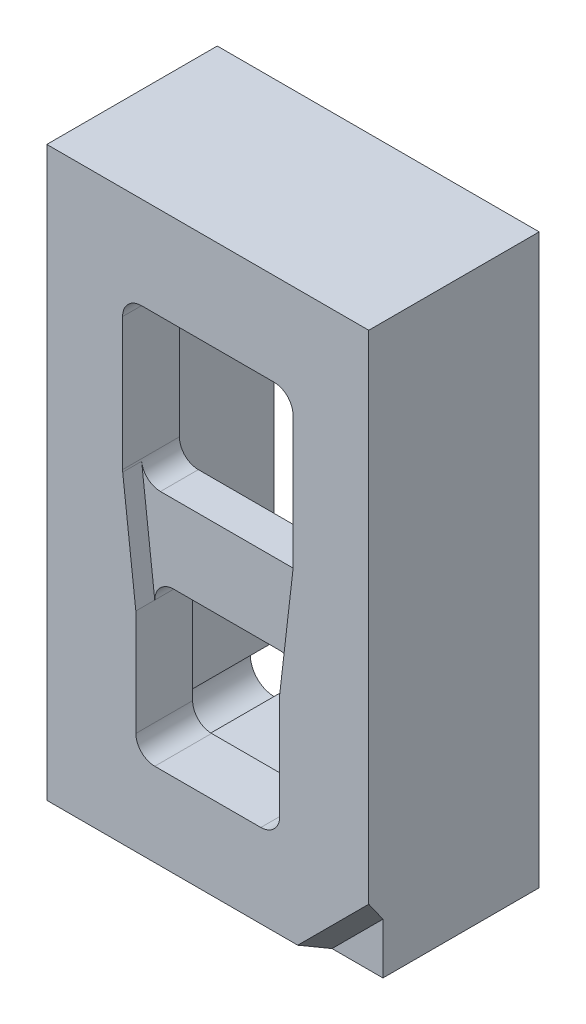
SolidWorks part; units mm, degrees
ref_plane "Front Plane" through (0, 0, 0) normal (0, 0, 1) x (1, 0, 0)
ref_plane "Top Plane" through (0, 0, 0) normal (0, 1, 0) x (1, 0, 0)
ref_plane "Right Plane" through (0, 0, 0) normal (1, 0, 0) x (0, 0, -1)
sketch "Sketch1" plane through (0, 0, 0) normal (0, 0, 1) x (1, 0, 0)
  line L0 (0, 0) -> (0, 1.125) construction
  line L1 (1.1, -2.4) -> (-1.1, -2.4)
  line L2 (1.1, -2.4) -> (1.1, 2.4)
  line L3 (1.1, 2.4) -> (-1.1, 2.4)
  line L4 (-1.1, -2.4) -> (-1.1, 2.4)
  line L5 (1.1, -2.4) -> (-1.1, 2.4) construction
  line L6 (1.1, 2.4) -> (-1.1, -2.4) construction
  line L7 (0, 0) -> (0, -1.258) construction
  line L8 (0, -1.258) -> (0, -1.358) construction
  line L9 (-0.9, 0.225) -> (0.9, 0.225)
  line L10 (-0.9, 0.225) -> (-0.9, 2.025)
  line L11 (-0.9, 2.025) -> (0.9, 2.025)
  line L12 (0.9, 0.225) -> (0.9, 2.025)
  line L13 (-0.9, 0.225) -> (0.9, 2.025) construction
  line L14 (-0.9, 2.025) -> (0.9, 0.225) construction
  line L15 (-0.76, -0.598) -> (0.76, -0.598)
  line L16 (-0.76, -0.598) -> (-0.76, -2.118)
  line L17 (-0.76, -2.118) -> (0.76, -2.118)
  line L18 (0.76, -0.598) -> (0.76, -2.118)
  line L19 (-0.76, -0.598) -> (0.76, -2.118) construction
  line L20 (-0.76, -2.118) -> (0.76, -0.598) construction
  point P0 (0, 0)
  dimension "D4" = 1.8
  dimension "D5" = 1.52
  dimension "D1" = 2.2
  dimension "D2" = 4.8
  dimension "D3" = 1.125
  dimension "D6" = 1.258
  dimension "D7" = 0.1
extrude "Boss-Extrude1" add sketch "Sketch1" along normal blind 0.6
sketch "Sketch2" plane through (0, 0, 0) normal (0, 0, 1) x (1, 0, 0)
  line L0 (1.7, 3) -> (-1.7, 3)
  line L1 (-1.7, 3) -> (-1.7, -3)
  line L2 (-1.7, -3) -> (1.7, -3)
  line L3 (1.7, -3) -> (1.7, 3)
  line L4 (-1.1, 2.4) -> (-1.1, -2.4)
  line L5 (-1.1, -2.4) -> (1.1, -2.4)
  line L6 (1.1, -2.4) -> (1.1, 2.4)
  line L7 (1.1, 2.4) -> (-1.1, 2.4)
  line L8 (-1.1, 2.4) -> (-1.1, -2.4)
  line L9 (-1.1, -2.4) -> (1.1, -2.4)
  line L10 (1.1, -2.4) -> (1.1, 2.4)
  line L11 (1.1, 2.4) -> (-1.1, 2.4)
  dimension "D1" = 0
  dimension "D2" = 0.6
extrude "Boss-Extrude2" add sketch "Sketch2" against normal blind 1.2
sketch "Sketch3" plane through (0, 0, 0) normal (0, 0, 1) x (1, 0, 0)
  line L4 (1.7, -3) -> (1.7, 3)
  line L5 (1.7, 3) -> (-1.7, 3)
  line L6 (-1.7, 3) -> (-1.7, -3)
  line L7 (-1.7, -3) -> (1.7, -3)
  line L8 (1.7, -3) -> (1.7, 3)
  line L9 (1.7, 3) -> (-1.7, 3)
  line L10 (-1.7, 3) -> (-1.7, -3)
  line L11 (-1.7, -3) -> (1.7, -3)
  line L12 (-1.1, 2.4) -> (-1.1, -2.4)
  line L13 (-1.1, -2.4) -> (1.1, -2.4)
  line L14 (1.1, -2.4) -> (1.1, 2.4)
  line L15 (1.1, 2.4) -> (-1.1, 2.4)
  line L16 (-1.1, 2.4) -> (-1.1, -2.4)
  line L17 (-1.1, -2.4) -> (1.1, -2.4)
  line L18 (1.1, -2.4) -> (1.1, 2.4)
  line L19 (1.1, 2.4) -> (-1.1, 2.4)
  dimension "D1" = 0
  dimension "D2" = 0
extrude "Boss-Extrude3" add sketch "Sketch3" along normal up to surface (0.6 mm away)
sketch "Sketch4" plane through (0, 0, 0.6) normal (0, 0, 1) x (1, 0, 0)
  line L1 (1.7, -3) -> (0.95, -3)
  line L3 (-1.7, -3) -> (1.7, -3) construction
  line L8 (0.95, -3) -> (1.7, -2.25)
  line L9 (1.7, -3) -> (1.7, 3) construction
  line L10 (1.7, -2.25) -> (1.7, -3)
  dimension "D1" = 0.75
extrude "Cut-Extrude1" cut sketch "Sketch4" against normal blind 0.15
fillet "Fillet1" radius 0.2 8 edges at (0.9, 0.225, 0.3) (0.76, -2.118, 0.3) (-0.9, 0.225, 0.3) (-0.76, -2.118, 0.3) (0.76, -0.598, 0.3) (0.9, 2.025, 0.3) (-0.76, -0.598, 0.3) (-0.9, 2.025, 0.3)
draft "Draft1" type of draft neutral plane draft angle 45 faces to draft 1 parameters "D1"=45
sketch "Sketch5" plane through (0, 0, 0.6) normal (0, 0, 1) x (1, 0, 0)
  line L0 (-0.8987, 0.402) -> (-0.76, -0.798)
  line L1 (0.76, -0.798) -> (0.8987, 0.402)
  line L2 (-0.8987, 0.402) -> (0.8987, 0.402)
  line L3 (-0.76, -0.798) -> (0.76, -0.798)
  arc A1 (0.7, 0.225) -> (0.9, 0.425) centre (0.7, 0.425) ccw construction
  arc A2 (-0.9, 0.425) -> (-0.7, 0.225) centre (-0.7, 0.425) ccw construction
extrude "Cut-Extrude2" cut sketch "Sketch5" against normal blind 0.2
sketch "Sketch6" [suppressed] plane through (0, 0, 1.2) normal (0, 0, 1) x (1, 0, 0)
  line L1 (0.76, -0.798) -> (0.8987, 0.402) construction
  line L2 (-0.8987, 0.402) -> (-0.76, -0.798) construction
  line L3 (0.76, -0.798) -> (0.8987, 0.402)
  line L4 (-0.8987, 0.402) -> (-0.76, -0.798)
  line L5 (-0.76, -0.798) -> (0.76, -0.798)
  line L6 (-0.8987, 0.402) -> (0.8987, 0.402)
extrude "Boss-Extrude4" [suppressed] add sketch "Sketch6" along normal blind 0.4 separate body
sketch "Sketch7" [suppressed] plane through (0, 0, 1.2) normal (0, 0, 1) x (1, 0, 0)
  line L0 (-0.9, 1.825) -> (-0.9, 0.425) construction
  line L1 (-0.9, 1.825) -> (-0.9, 0.425)
  line L2 (-0.56, -2.118) -> (0.56, -2.118) construction
  line L3 (-0.76, -0.798) -> (-0.76, -1.918) construction
  line L4 (-0.8987, 0.402) -> (-0.76, -0.798) construction
  line L5 (0.76, -1.918) -> (0.76, -0.798) construction
  line L6 (0.76, -0.798) -> (0.8987, 0.402) construction
  line L7 (0.9, 0.425) -> (0.9, 1.825) construction
  line L8 (0.7, 2.025) -> (-0.7, 2.025) construction
  line L9 (-0.56, -2.118) -> (0.56, -2.118)
  line L10 (-0.76, -0.798) -> (-0.76, -1.918)
  line L11 (-0.8987, 0.402) -> (-0.76, -0.798)
  line L12 (0.76, -1.918) -> (0.76, -0.798)
  line L13 (0.76, -0.798) -> (0.8987, 0.402)
  line L14 (0.9, 0.425) -> (0.9, 1.825)
  line L15 (0.7, 2.025) -> (-0.7, 2.025)
  arc A0 (-0.9, 0.425) -> (-0.8987, 0.402) centre (-0.7, 0.425) ccw construction
  arc A1 (0.56, -2.118) -> (0.76, -1.918) centre (0.56, -1.918) ccw construction
  arc A2 (-0.76, -1.918) -> (-0.56, -2.118) centre (-0.56, -1.918) ccw construction
  arc A3 (0.8987, 0.402) -> (0.9, 0.425) centre (0.7, 0.425) ccw construction
  arc A4 (0.9, 1.825) -> (0.7, 2.025) centre (0.7, 1.825) ccw construction
  arc A5 (-0.7, 2.025) -> (-0.9, 1.825) centre (-0.7, 1.825) ccw construction
  arc A6 (-0.9, 0.425) -> (-0.8987, 0.402) centre (-0.7, 0.425) ccw
  arc A7 (0.56, -2.118) -> (0.76, -1.918) centre (0.56, -1.918) ccw
  arc A8 (-0.76, -1.918) -> (-0.56, -2.118) centre (-0.56, -1.918) ccw
  arc A9 (0.8987, 0.402) -> (0.9, 0.425) centre (0.7, 0.425) ccw
  arc A10 (0.9, 1.825) -> (0.7, 2.025) centre (0.7, 1.825) ccw
  arc A11 (-0.7, 2.025) -> (-0.9, 1.825) centre (-0.7, 1.825) ccw
extrude "Boss-Extrude5" [suppressed] add sketch "Sketch7" along normal blind 0.4 draft 45 separate body
sketch "Sketch9" plane through (0, 0, -1.2) normal (0, 0, -1) x (-1, 0, 0)
  circle A0 centre (1.1, 2.4) radius 0.25
  circle A1 centre (-1.1, 2.4) radius 0.25
  circle A2 centre (1.1, -2.4) radius 0.25
  circle A3 centre (-1.1, -2.4) radius 0.25
  dimension "D1" = 0.5
extrude "Cut-Extrude4" cut sketch "Sketch9" against normal up to surface (1.2 mm away)
